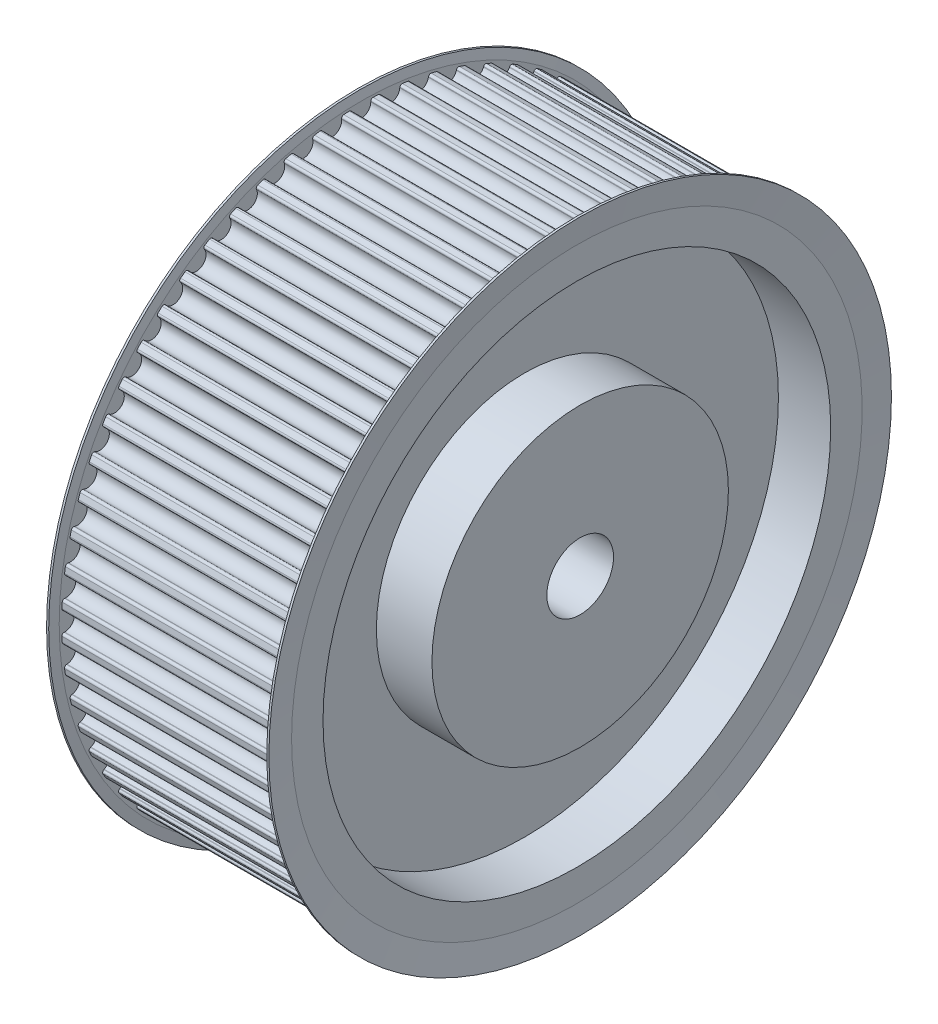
SolidWorks part; units mm, degrees
ref_plane "Vorne" through (0, 0, 0) normal (0, 0, 1) x (1, 0, 0)
ref_plane "Oben" through (0, 0, 0) normal (0, 1, 0) x (1, 0, 0)
ref_plane "Rechts" through (0, 0, 0) normal (1, 0, 0) x (0, 0, -1)
sketch "Skizze1" plane through (0, 0, 0) normal (0, 0, 1) x (1, 0, 0)
  line L0 (-29.105, 0) -> (40.031, 0) construction
  line L1 (29.105, 40) -> (30, 40)
  line L2 (-29.105, 0) -> (30, 0)
  line L3 (-29.105, 0) -> (-29.105, 80.8)
  line L4 (-29.105, 80.8) -> (29.105, 80.8)
  line L5 (29.105, 0) -> (29.105, 40) construction
  line L6 (30, 40) -> (30, 0)
  line L7 (0, 0) -> (0, 80.8) construction
  line L8 (29.105, 40) -> (29.105, 80.8)
  dimension "Breite" = 58.21
  dimension "Zahnscheibenaussendurchmesser" = 161.6
  dimension "L" = 59.105
  dimension "ND" = 80
revolve "Basis" add sketch "Skizze1" angle 360 about L0
sketch "Skizze2" plane through (29.105, 0, 0) normal (1, 0, 0) x (0, 0, -1)
  line L0 (2.1531, 80.7713) -> (1.25, 78.29)
  line L2 (0, 0) -> (0, 28.8002) construction
  line L3 (-2.1531, 80.7713) -> (-1.25, 78.29)
  circle A0 centre (0, 0) radius 80.8 construction
  arc A1 (1.25, 78.29) -> (-1.25, 78.29) centre (0, 0) ccw
  arc A2 (2.1531, 80.7713) -> (-2.1531, 80.7713) centre (0, 0) ccw
  dimension "Winkel" = 40
  dimension "Zahnfußbreite" = 2.5
  dimension "Zahntiefe" = 2.5
extrude "Zahnform" [suppressed] cut sketch "Skizze2" against normal through all
fillet "Zahnverrundung" [suppressed] radius 0.3
pattern_circular "Zähnezahl" [suppressed] count 64 over 360 about axis through (-29.105, 0, 0) along (1, 0, 0)
sketch "Skizze8" plane through (-29.105, 0, 0) normal (-1, 0, 0) x (0, 0, 1)
  line L0 (-2.6, 80) -> (-2.6, 80.1361)
  line L1 (2.6, 80) -> (2.6, 80.1361)
  line L2 (0, 80) -> (0, 42.1227) construction
  arc A0 (-2.6, 80) -> (2.6, 80) centre (0, 80) ccw
  circle A1 centre (0, 0) radius 80.8 construction
  arc A2 (-3.2239, 80.7357) -> (-2.6, 80.1361) centre (-3.2, 80.1361) cw
  arc A3 (3.2239, 80.7357) -> (2.6, 80.1361) centre (3.2, 80.1361) ccw
  arc A5 (-3.2239, 80.7357) -> (3.2239, 80.7357) centre (0, 0) cw
  dimension "Zahnradius" = 5.2
  dimension "Radius" = 0.6
  dimension "Zahnhöhe" = 3.4
extrude "HTD-Profil" cut sketch "Skizze8" against normal up to vertex (58.21 mm away)
pattern_circular "Zähnezahl HTD" count 64 over 360 about axis through (0, 0, 0) along (1, 0, 0) of "HTD-Profil"
sketch "Skizze7" plane through (0, 0, 0) normal (0, 0, 1) x (1, 0, 0)
  line L0 (-29.105, 76.985) -> (-30, 84)
  line L1 (-30, 40) -> (-29.105, 40)
  line L2 (-30, 40) -> (-30, 0)
  line L3 (-30, 0) -> (-29.105, 0)
  line L4 (-29.105, 40) -> (-29.105, 0)
  line L9 (-30, 84) -> (-29.4259, 84)
  line L10 (-29.4259, 84) -> (-29.105, 81.485)
  line L11 (-29.105, 81.485) -> (-29.105, 76.985)
  line L12 (0, 0) -> (0, 29.0736) construction
  line L13 (29.105, 81.485) -> (29.105, 76.985)
  line L14 (29.4259, 84) -> (29.105, 81.485)
  line L15 (30, 84) -> (29.4259, 84)
  line L16 (29.105, 76.985) -> (30, 84)
  line L19 (-29.105, 0) -> (-29.105, 80.8) construction
  line L20 (-29.105, 0) -> (30, 0) construction
  line L22 (0, 0) -> (25.378, 0) construction
  line L23 (-29.105, 0) -> (40.031, 0) construction
  dimension "b" = 60
  dimension "Bordscheibendurchmessser" = 168
  dimension "D2" = 0.895
  dimension "WD" = 162.97
  dimension "SA" = 4.5
revolve "Rotation1" add sketch "Skizze7" angle 360 about L22
sketch "Skizze10" [suppressed] plane through (0, 0, 0) normal (0, 0, 1) x (1, 0, 0)
  line L0 (-4.6574, 9) -> (-4.205, 7.16) construction
  line L1 (-5.1, 9) -> (-4.6574, 9) construction
  line L2 (-4.205, 5.36) -> (-5.1, 9) construction
  line L3 (-4.6574, 9) -> (-4.205, 7.16)
  line L4 (-5.1, 9) -> (-4.6574, 9)
  line L5 (-4.205, 5.36) -> (-5.1, 9)
  line L6 (-4.205, 7.16) -> (-4.205, 5.36)
  line L7 (-5.1, 8.75) -> (-5.1, 0) construction
  line L8 (-5.1, 4.36) -> (-4.205, 4.36)
  line L9 (-5.1, 4.36) -> (-5.1, 0)
  line L10 (-5.1, 0) -> (-4.205, 0)
  line L11 (-4.205, 4.36) -> (-4.205, 0)
  line L12 (0, 0) -> (16.9789, 0) construction
  line L13 (0, 0) -> (25.378, 0) construction
  dimension "D1" = 1
revolve "Ausführung OF" [suppressed] add sketch "Skizze10" angle 360 about L12
sketch "Skizze6" plane through (0, 0, 0) normal (1, 0, 0) x (0, 0, -1)
  circle A0 centre (0, 0) radius 9
  dimension "B" = 18
extrude "Vorbohrung" cut sketch "Skizze6" against normal through all and the other way through all
sketch "Skizze9" plane through (0, 0, 0) normal (0, 0, 1) x (1, 0, 0)
  line L1 (-29.105, 68.5) -> (-15, 68.5)
  line L2 (-29.105, 68.5) -> (-29.105, 40)
  line L3 (-29.105, 40) -> (-15, 40)
  line L4 (-15, 68.5) -> (-15, 40)
  line L5 (15, 68.5) -> (29.105, 68.5)
  line L6 (15, 68.5) -> (15, 40)
  line L7 (15, 40) -> (29.105, 40)
  line L8 (29.105, 68.5) -> (29.105, 40)
  line L9 (0, 0) -> (0, 53.729) construction
  line L11 (0, 0) -> (44.8654, 0) construction
  dimension "Stegdicke" = 30
  dimension "Da" = 137
revolve "Schnitt" cut sketch "Skizze9" angle 360 about L11
